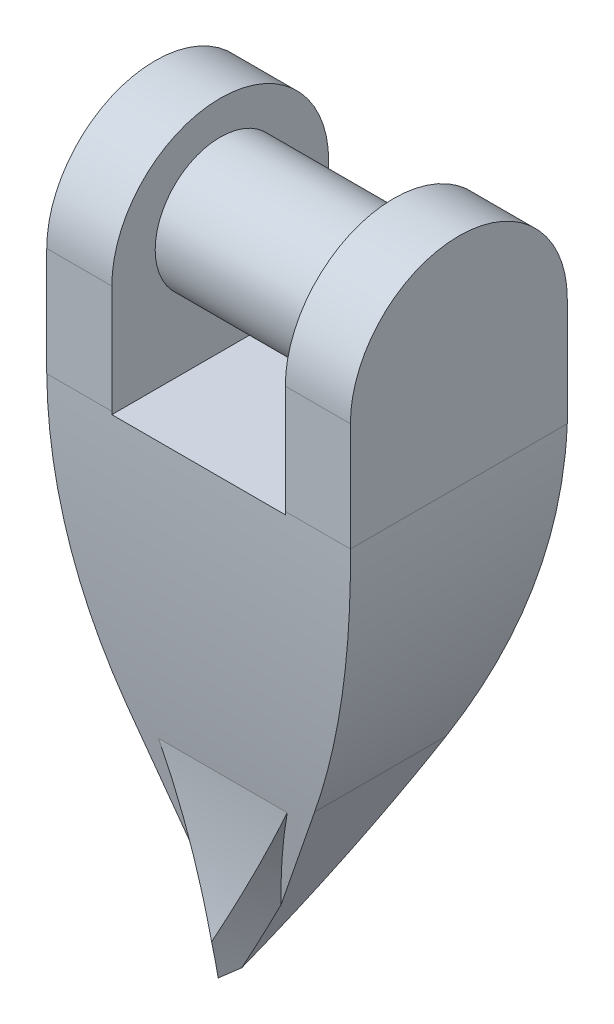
SolidWorks part; units mm, degrees
ref_plane "Front Plane" through (0, 0, 0) normal (0, 0, 1) x (1, 0, 0)
ref_plane "Top Plane" through (0, 0, 0) normal (0, 1, 0) x (1, 0, 0)
ref_plane "Right Plane" through (0, 0, 0) normal (1, 0, 0) x (0, 0, -1)
sketch "Sketch1" plane through (0, 0, 0) normal (0, 0, 1) x (1, 0, 0)
  line L0 (-45.2068, 16.3695) -> (-42.2068, 16.3695)
  line L1 (-56.2068, 16.3695) -> (-56.2068, 6.3695)
  line L3 (-42.2068, 6.3695) -> (-42.2068, 16.3695)
  line L5 (-56.2068, 16.3695) -> (-53.2068, 16.3695)
  line L6 (-53.2068, 8.2323) -> (-45.2068, 8.2323)
  line L7 (-53.2068, 8.2323) -> (-53.2068, 16.3695)
  line L8 (-53.556, -5.96) -> (-49.2068, -15.6076)
  line L9 (-45.2068, 8.2323) -> (-45.2068, 16.3695)
  line L10 (-49.2068, -15.6076) -> (-44.8575, -5.96)
  arc A0 (-44.8575, -5.96) -> (-42.2068, 6.3695) centre (-72.2068, 6.3695) ccw
  arc A1 (-53.556, -5.96) -> (-56.2068, 6.3695) centre (-26.2068, 6.3695) cw
  dimension "D1" = 30
  dimension "D2" = 30
extrude "Boss-Extrude1" add sketch "Sketch1" along normal blind 10
sketch "Sketch2" plane through (0, 8.2323, 0) normal (0, 1, 0) x (1, 0, 0)
  line L1 (-53.2068, 0) -> (-45.2068, 0)
  line L2 (-53.2068, 0) -> (-53.2068, -10)
  line L3 (-53.2068, -10) -> (-45.2068, -10)
  line L4 (-45.2068, 0) -> (-45.2068, -10)
extrude "Cut-Extrude1" cut sketch "Sketch2" against normal blind 2
sketch "Sketch3" plane through (-45.2068, 0, 0) normal (-1, 0, 0) x (0, 0, 1)
  circle A0 centre (5, 11.8175) radius 3
extrude "Boss-Extrude2" add sketch "Sketch3" along normal blind 8
sketch "Sketch4" plane through (-56.2068, 0, 0) normal (-1, 0, 0) x (0, 0, 1)
  line L1 (0, 11.3695) -> (0, 16.3695)
  line L2 (0, 16.3695) -> (10, 16.3695)
  line L3 (10, 16.3695) -> (10, 11.3695)
  circle A1 centre (5, 11.3695) radius 5
extrude "Cut-Extrude2" cut sketch "Sketch4" against normal blind 24 contours A1 L2 M1 | A1 M3 M4
sketch "Sketch5" plane through (-56.2068, 0, 0) normal (-1, 0, 0) x (0, 0, 1)
  line L0 (0, 6.3695) -> (0, -15.6076)
  line L1 (0, -15.6076) -> (10, -15.6076)
  spline S0 degree 2 poles (0, 6.3695) (0.5399, -6.593) (10, -15.6076) knots 0 0 0 1 1 1
extrude "Cut-Extrude3" cut sketch "Sketch5" against normal blind 32
sketch "Sketch6" plane through (-56.2068, 0, 0) normal (-1, 0, 0) x (0, 0, 1)
  line L0 (10, 6.3695) -> (10, -15.6076)
  spline S0 degree 2 poles (10, 6.3695) (9.9281, -0.2276) (8.8764, -6.7392) knots 0 0 0 1 1 1
  spline S1 degree 2 poles (8.8764, -6.7392) (8.7461, -11.2494) (10, -15.6076) knots 0 0 0 1 1 1
extrude "Cut-Extrude4" cut sketch "Sketch6" against normal blind 32
chamfer "Chamfer2" distance 1 angle 45 2 edges at (-47.204, -11.1649, 9.0863) (-51.1691, -11.2548, 9.0977)
